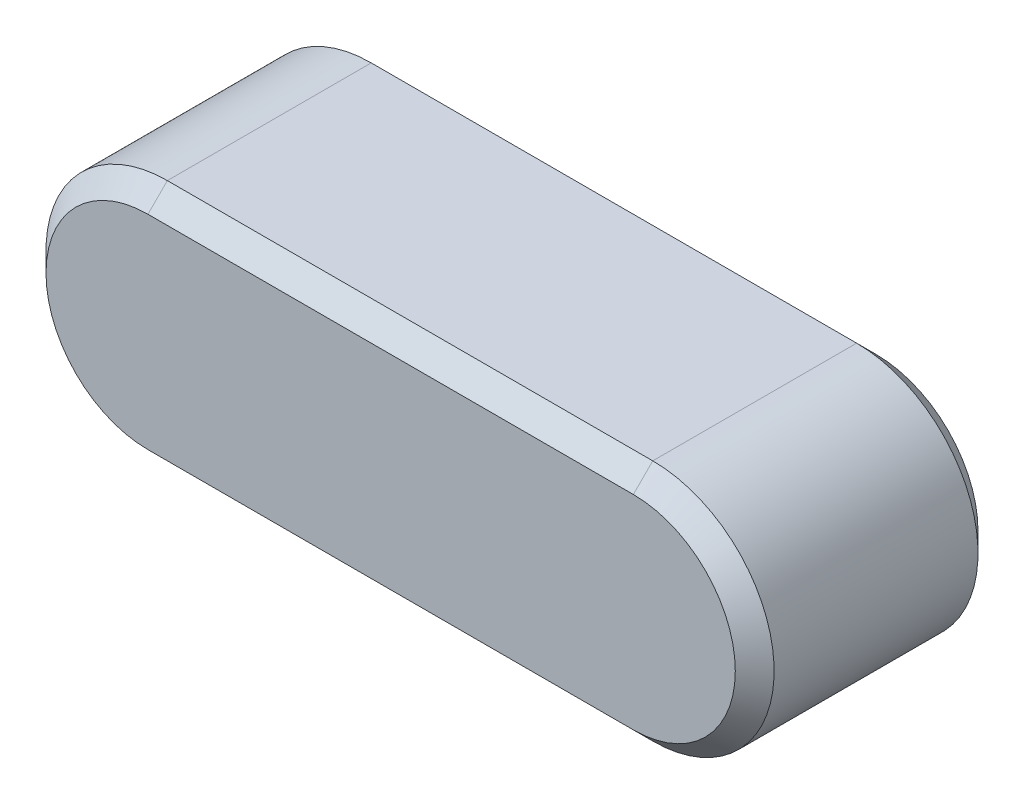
SolidWorks part; units mm, degrees
ref_plane "Front" through (0, 0, 0) normal (0, 0, 1) x (1, 0, 0)
ref_plane "Top" through (0, 0, 0) normal (0, 1, 0) x (1, 0, 0)
ref_plane "Right" through (0, 0, 0) normal (1, 0, 0) x (0, 0, -1)
other "Configuration Table"
sketch "Sketch1" plane through (0, 0, 0) normal (0, 0, 1) x (1, 0, 0)
  line L0 (0, 1) -> (-4, 1)
  line L1 (-4, -1) -> (0, -1)
  arc A0 (-4, 1) -> (-4, -1) centre (-4, 0) ccw
  arc A1 (0, -1) -> (0, 1) centre (0, 0) ccw
  dimension "b" = 2
  dimension "l" = 6
extrude "Extrude1" add sketch "Sketch1" along normal blind 2
sketch "Sketch3" plane through (0, 0, 0) normal (0, 0, 1) x (1, 0, 0)
  line L0 (-4, -1) -> (0, -1) construction
  line L1 (-4, -1) -> (1, -1)
  line L3 (-4, 1) -> (1, 1)
  line L4 (1, -1) -> (1, 1)
  arc A1 (-4, 1) -> (-4, -1) centre (-4, 0) ccw
  arc A2 (0, -1) -> (0, 1) centre (0, 0) ccw construction
  arc A3 (-4, 1) -> (-4, -1) centre (-4, 0) ccw construction
extrude "Extrude2" [suppressed] add sketch "Sketch3" along normal blind 2
chamfer "Chamfer1" distance 0.16 angle 45 8 edges at (-2, 1, 0) (-2, -1, 0) (-2, 1, 2) (-2, -1, 2) (-5, 0, 0) (-5, 0, 2) (1, 0, 0) (1, 0, 2)
equation "\"D1@Extrude2\" = \"h@Extrude1\""
